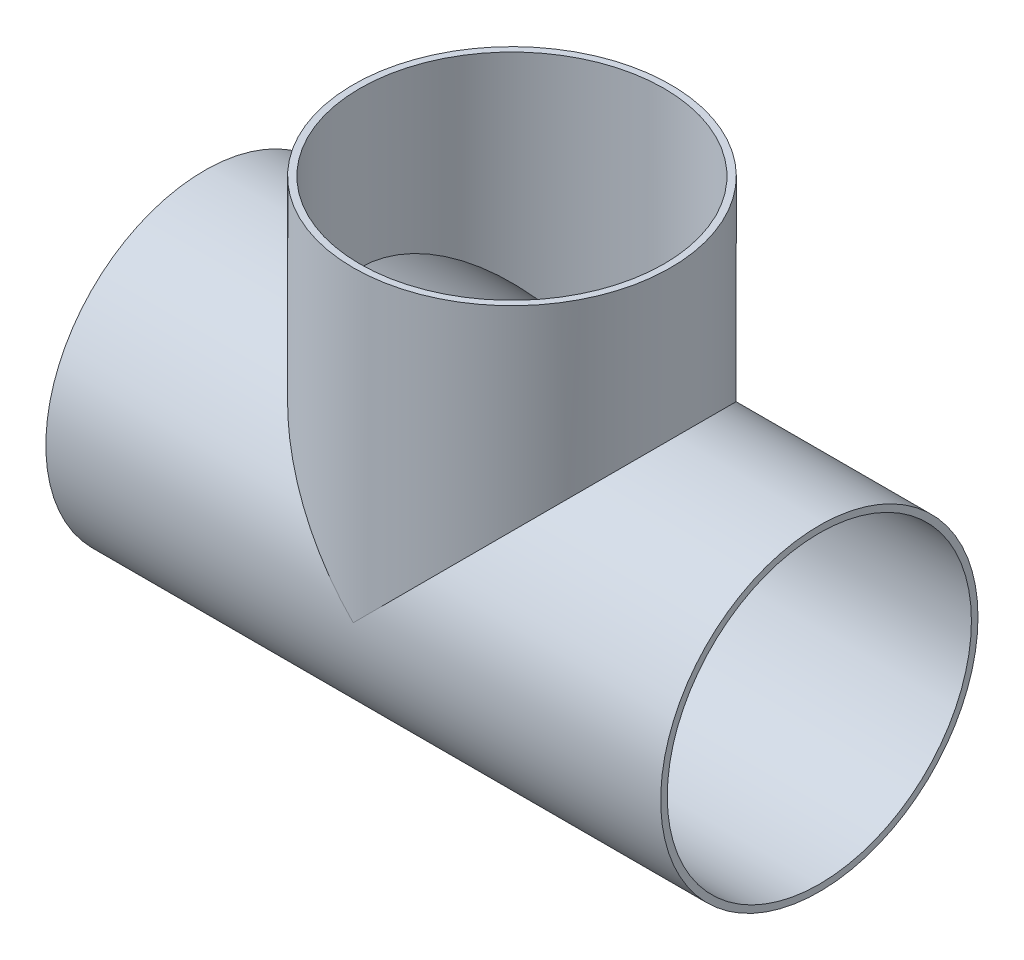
SolidWorks part; units mm, degrees
ref_plane "Front Plane" through (0, 0, 0) normal (0, 0, 1) x (1, 0, 0)
ref_plane "Top Plane" through (0, 0, 0) normal (0, 1, 0) x (1, 0, 0)
ref_plane "Right Plane" through (0, 0, 0) normal (1, 0, 0) x (0, 0, -1)
sketch "Sketch1" plane through (0, 0, 0) normal (1, 0, 0) x (0, 0, -1)
  circle A0 centre (0, 0) radius 50.8
  dimension "D1" = 101.6
extrude "Boss-Extrude1" add sketch "Sketch1" along normal mid plane 196.85
sketch "Sketch2" plane through (0, 0, 0) normal (0, 1, 0) x (1, 0, 0)
  circle A0 centre (0, 0) radius 50.8
  dimension "D1" = 101.6
extrude "Boss-Extrude2" add sketch "Sketch2" along normal blind 98.425
sketch "Sketch3" plane through (0, 0, 0) normal (0, 1, 0) x (1, 0, 0)
  circle A0 centre (0, 0) radius 48.6918
  dimension "D1" = 97.3836
extrude "Cut-Extrude1" cut sketch "Sketch3" along normal blind 98.425
sketch "Sketch4" plane through (0, 0, 0) normal (1, 0, 0) x (0, 0, -1)
  circle A0 centre (0, 0) radius 48.6918
  dimension "D1" = 97.3836
extrude "Cut-Extrude2" cut sketch "Sketch4" against normal mid plane 196.85
